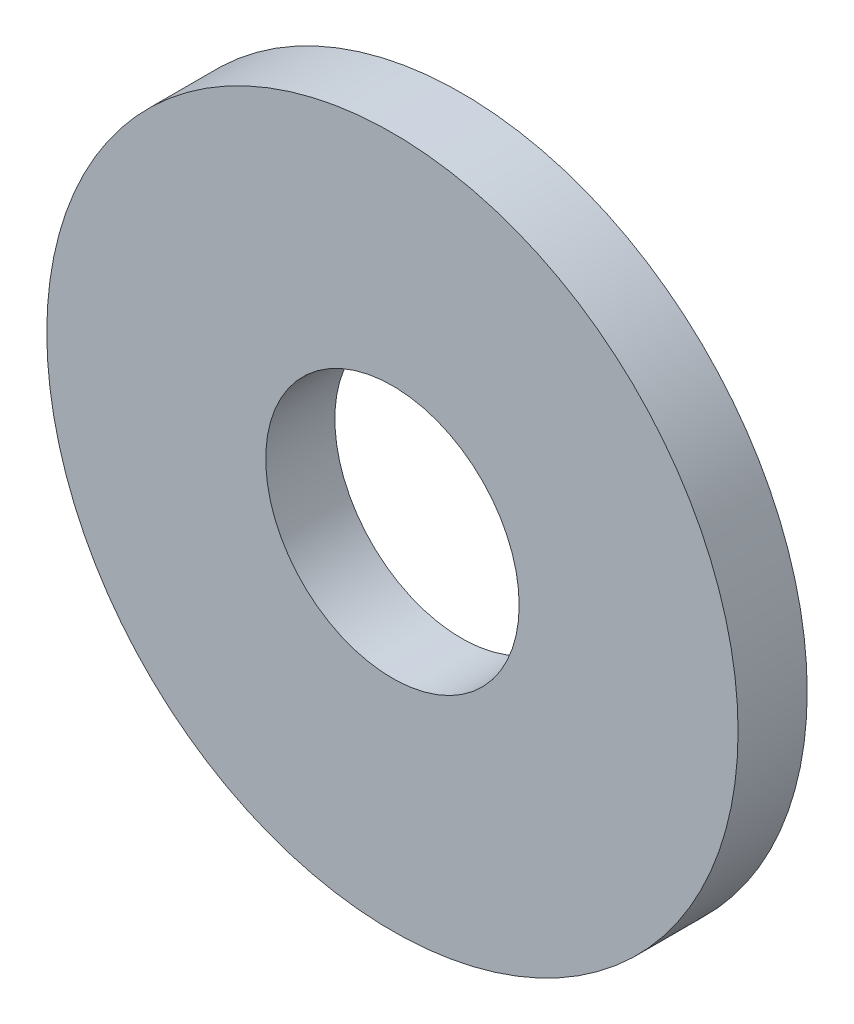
SolidWorks part; units mm, degrees
ref_plane "Plan1" through (0, 0, 0) normal (0, 0, 1) x (1, 0, 0)
ref_plane "Plan2" through (0, 0, 0) normal (0, 1, 0) x (1, 0, 0)
ref_plane "Plan3" through (0, 0, 0) normal (1, 0, 0) x (0, 0, -1)
sketch "Esquisse1" plane through (0, 0, 0) normal (0, 0, 1) x (1, 0, 0)
  circle A0 centre (0, 0) radius 1.1
  circle A1 centre (0, 0) radius 3
  dimension "D1" = 2.2
  dimension "D2" = 6
extrude "Base-Extrusion" add sketch "Esquisse1" along normal blind 0.6
